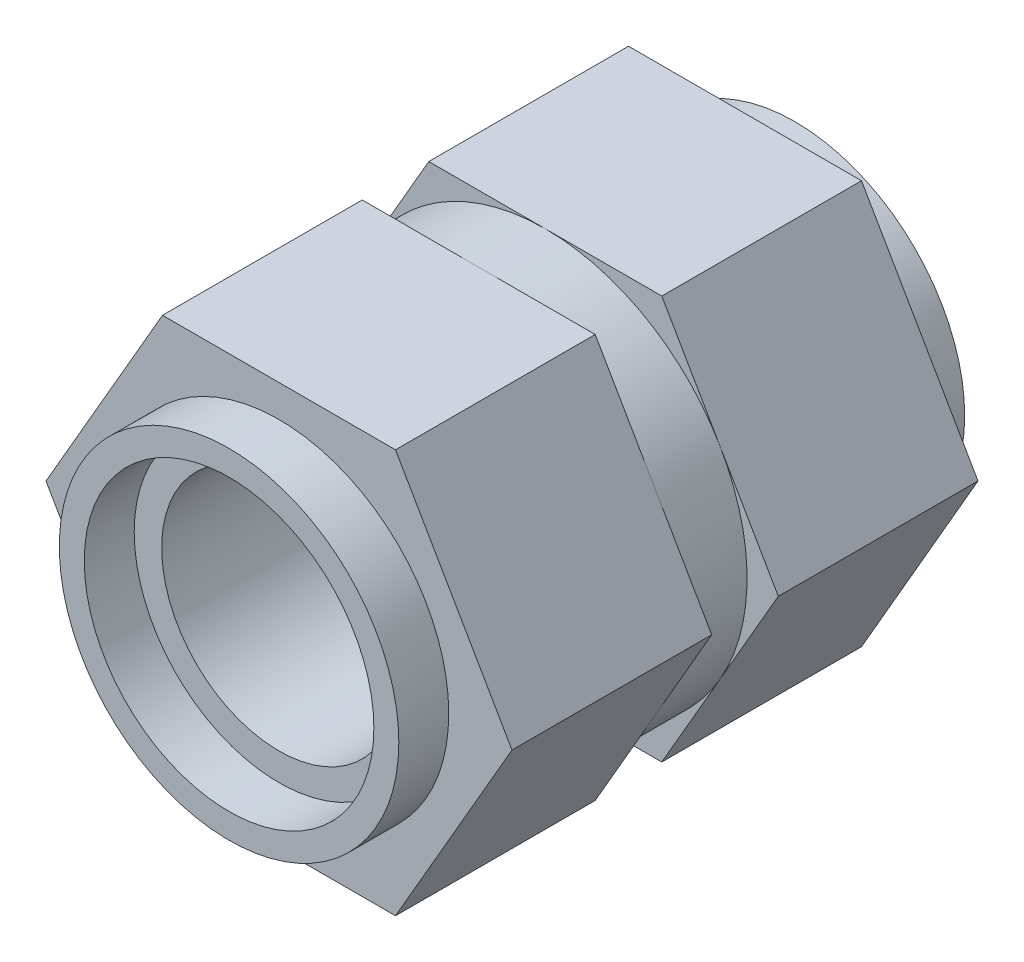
SolidWorks part; units mm, degrees
ref_plane "Front Plane" through (0, 0, 0) normal (0, 0, 1) x (1, 0, 0)
ref_plane "Top Plane" through (0, 0, 0) normal (0, 1, 0) x (1, 0, 0)
ref_plane "Right Plane" through (0, 0, 0) normal (1, 0, 0) x (0, 0, -1)
sketch "Sketch1" plane through (0, 0, 0) normal (0, 0, 1) x (1, 0, 0)
  line L1 (7, 0) -> (3.5, 6.0622)
  line L2 (3.5, 6.0622) -> (-3.5, 6.0622)
  line L3 (-3.5, 6.0622) -> (-7, 0)
  line L4 (-7, 0) -> (-3.5, -6.0622)
  line L5 (-3.5, -6.0622) -> (3.5, -6.0622)
  line L6 (3.5, -6.0622) -> (7, 0)
  circle A0 centre (0, 0) radius 6.0622 construction
  dimension "D1" = 14
extrude "Boss-Extrude1" add sketch "Sketch1" along normal blind 6
sketch "Sketch2" plane through (0, 0, 6) normal (0, 0, 1) x (1, 0, 0)
  circle A0 centre (0, 0) radius 6.0622
extrude "Boss-Extrude2" add sketch "Sketch2" along normal blind 2
sketch "Sketch3" plane through (0, 0, 8) normal (0, 0, 1) x (1, 0, 0)
  line L1 (7, 0) -> (3.5, 6.0622)
  line L2 (3.5, 6.0622) -> (-3.5, 6.0622)
  line L3 (-3.5, 6.0622) -> (-7, 0)
  line L4 (-7, 0) -> (-3.5, -6.0622)
  line L5 (-3.5, -6.0622) -> (3.5, -6.0622)
  line L6 (3.5, -6.0622) -> (7, 0)
  circle A0 centre (0, 0) radius 6.0622 construction
  dimension "D1" = 14
extrude "Boss-Extrude3" add sketch "Sketch3" along normal blind 6
sketch "Sketch4" plane through (0, 0, 14) normal (0, 0, 1) x (1, 0, 0)
  circle A0 centre (0, 0) radius 3.525
  dimension "D1" = 7.05
extrude "Cut-Extrude1" cut sketch "Sketch4" against normal blind 11.5
sketch "Sketch5" plane through (0, 0, 0) normal (0, 0, -1) x (-1, 0, 0)
  circle A0 centre (0, 0) radius 5.1
  circle A1 centre (0, 0) radius 4.35
  dimension "D1" = 10.2
  dimension "D2" = 8.7
extrude "Boss-Extrude4" add sketch "Sketch5" along normal blind 1.5
sketch "Sketch6" plane through (0, 0, 14) normal (0, 0, 1) x (1, 0, 0)
  circle A0 centre (0, 0) radius 5.1
  circle A1 centre (0, 0) radius 4.35
  dimension "D1" = 10.2
  dimension "D2" = 8.7
extrude "Boss-Extrude5" add sketch "Sketch6" along normal blind 1.5
sketch "Sketch7" plane through (0, 0, 0) normal (0, 0, -1) x (-1, 0, 0)
  circle A0 centre (0, 0) radius 1.5
  dimension "D1" = 3
extrude "Cut-Extrude2" cut sketch "Sketch7" against normal up to surface (2.5 mm away)
